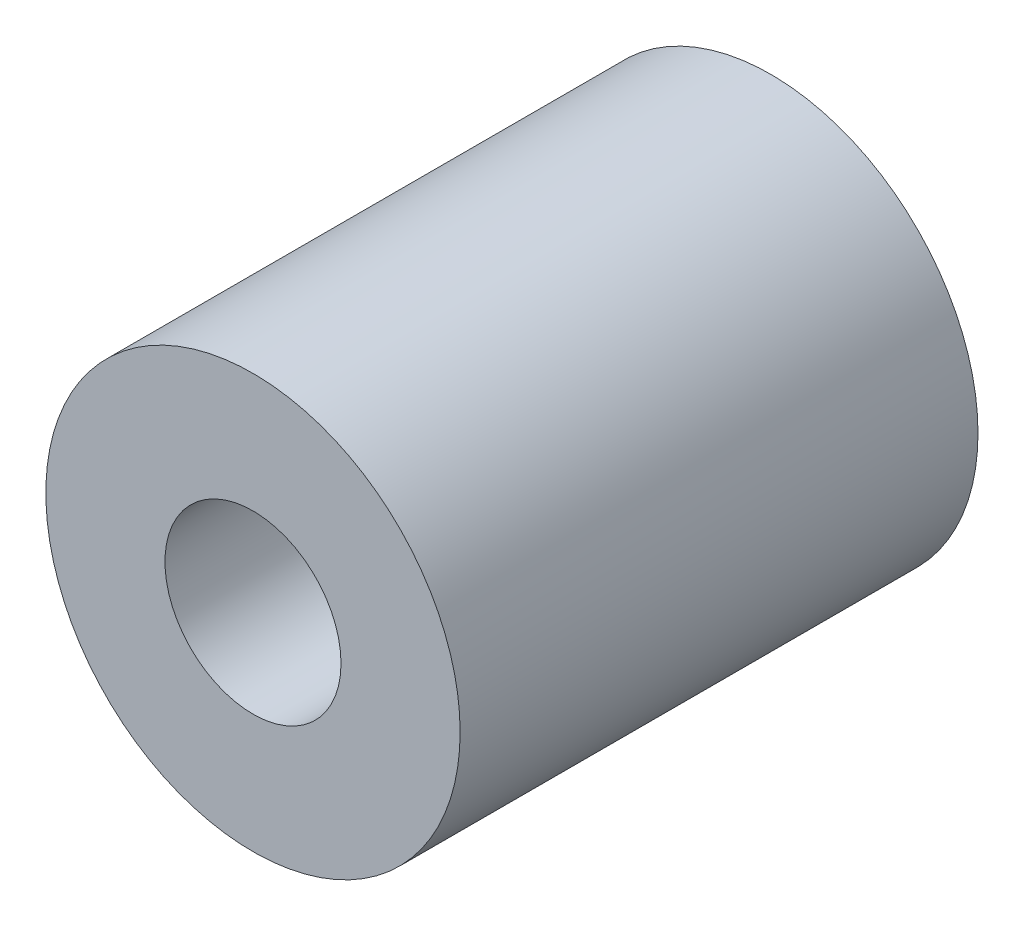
SolidWorks part; units mm, degrees
ref_plane "前视基准面" through (0, 0, 0) normal (0, 0, 1) x (1, 0, 0)
ref_plane "上视基准面" through (0, 0, 0) normal (0, 1, 0) x (1, 0, 0)
ref_plane "右视基准面" through (0, 0, 0) normal (1, 0, 0) x (0, 0, -1)
other "Configuration Table"
sketch "草图1" plane through (0, 0, 0) normal (0, 0, 1) x (1, 0, 0)
  circle A0 centre (0, 0) radius 4
  circle A1 centre (0, 0) radius 1.7
  dimension "D1" = 3.4
  dimension "D2" = 8
extrude "M3_spacer_10" add sketch "草图1" along normal blind 10
